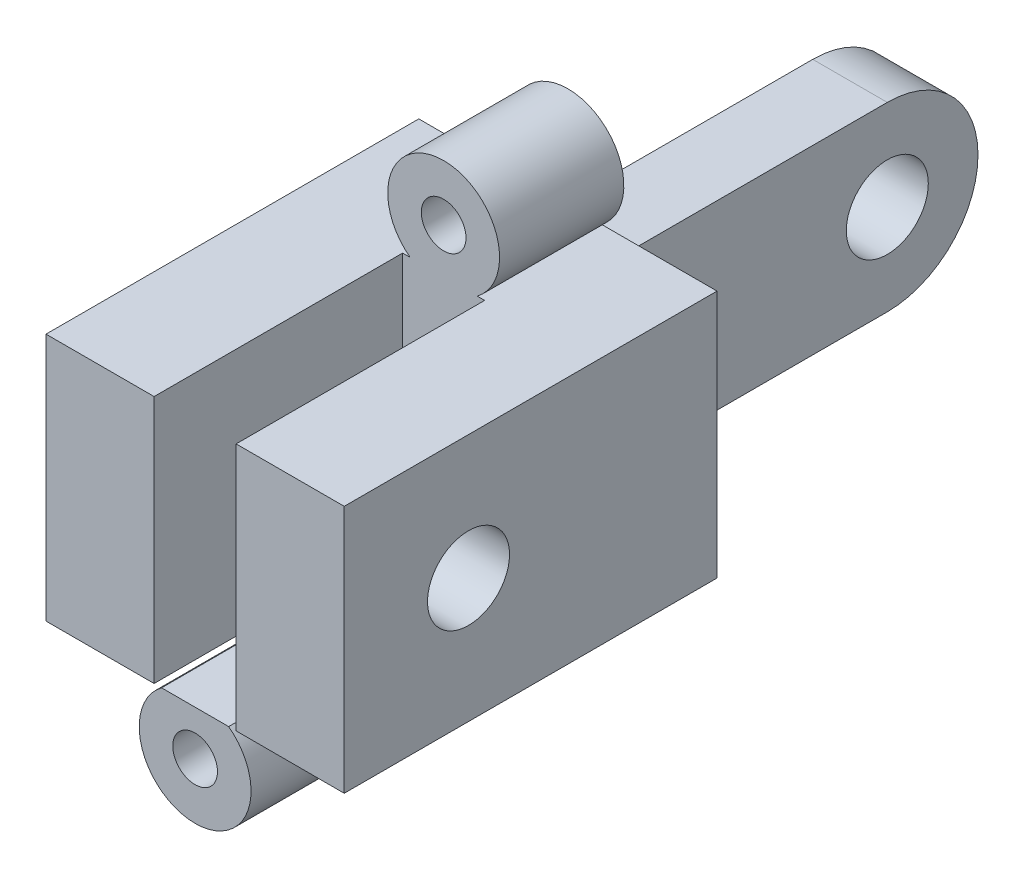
SolidWorks part; units mm, degrees
ref_plane "Front Plane" through (0, 0, 0) normal (0, 0, 1) x (1, 0, 0)
ref_plane "Top Plane" through (0, 0, 0) normal (0, 1, 0) x (1, 0, 0)
ref_plane "Right Plane" through (0, 0, 0) normal (1, 0, 0) x (0, 0, -1)
sketch "Sketch1" plane through (0, 0, 0) normal (0, 1, 0) x (1, 0, 0)
  line L0 (7.65, 0) -> (12, 0)
  line L1 (0, 0) -> (4.35, 0)
  line L2 (0, 0) -> (0, 20)
  line L3 (4.5, 30) -> (7.5, 30)
  line L4 (12, 0) -> (12, 20)
  line L6 (4.35, 0) -> (4.35, 10)
  line L7 (4.35, 10) -> (7.65, 10)
  line L8 (7.65, 0) -> (7.65, 10)
  line L11 (0, 20) -> (4.5, 20)
  line L12 (4.5, 30) -> (4.5, 20)
  line L15 (12, 20) -> (7.5, 20)
  line L16 (7.5, 30) -> (7.5, 20)
  dimension "D1" = 12
  dimension "D3" = 3
  dimension "D4" = 4.5
  dimension "D5" = 10
  dimension "D6" = 10
  dimension "D7" = 3.3
  dimension "D8" = 4.35
  dimension "D9" = 10
extrude "Boss-Extrude1" add sketch "Sketch1" along normal blind 10
sketch "Sketch2" plane through (7.5, 0, 0) normal (1, 0, 0) x (0, 0, -1)
  line L0 (30, 10) -> (30, 0) construction
  line L1 (20, 10) -> (30, 10) construction
  circle A0 centre (26.35, 5) radius 1.65
  dimension "D1" = 3.3
  dimension "D2" = 3.65
  dimension "D3" = 5
extrude "Cut-Extrude1" cut sketch "Sketch2" against normal blind 10
sketch "Sketch3" plane through (7.5, 0, 0) normal (1, 0, 0) x (0, 0, -1)
  line L0 (30, 10) -> (30, 0) construction
  line L1 (20, 10) -> (30, 10)
  line L2 (20, 10) -> (20, 8.65)
  line L3 (20, 8.65) -> (30, 8.65)
  line L4 (30, 10) -> (30, 8.65)
  line L6 (20, 0) -> (30, 0)
  line L7 (20, 0) -> (20, 1.35)
  line L8 (20, 1.35) -> (30, 1.35)
  line L9 (30, 0) -> (30, 1.35)
  circle A0 centre (26.35, 5) radius 1.65 construction
  dimension "D1" = 3.65
  dimension "D2" = 3.65
extrude "Cut-Extrude2" cut sketch "Sketch3" against normal blind 10
fillet "Fillet2" radius 3.65 2 edges at (6, 1.35, -30) (6, 8.65, -30)
sketch "Sketch4" plane through (12, 0, 0) normal (1, 0, 0) x (0, 0, -1)
  line L0 (0, 0) -> (20, 0) construction
  line L1 (0, 10) -> (0, 0) construction
  circle A0 centre (5, 5) radius 1.65
  dimension "D3" = 3.3
  dimension "D1" = 5
  dimension "D2" = 5
extrude "Cut-Extrude3" cut sketch "Sketch4" against normal through all
sketch "Sketch5" plane through (0, 10, 0) normal (0, 1, 0) x (1, 0, 0)
  line L0 (12, 0) -> (12, 20) construction
  line L1 (7.5, 20) -> (12, 20)
  line L2 (7.5, 20) -> (7.5, 15)
  line L3 (7.5, 15) -> (12, 15)
  line L4 (12, 20) -> (12, 15)
  line L5 (0, 20) -> (0, 0) construction
  line L6 (4.5, 20) -> (0, 20)
  line L7 (4.5, 20) -> (4.5, 15)
  line L8 (4.5, 15) -> (0, 15)
  line L9 (0, 20) -> (0, 15)
  dimension "D1" = 5
  dimension "D2" = 5
extrude "Cut-Extrude4" cut sketch "Sketch5" against normal blind 10
sketch "Sketch6" plane through (0, 10, 0) normal (0, 1, 0) x (1, 0, 0)
  line L1 (4.5, 20) -> (7.5, 20)
  line L2 (4.5, 20) -> (4.5, 15)
  line L3 (4.5, 15) -> (7.5, 15)
  line L4 (7.5, 20) -> (7.5, 15)
extrude "Cut-Extrude5" cut sketch "Sketch6" against normal blind 1.35
sketch "Sketch7" plane through (0, 0, 0) normal (0, -1, 0) x (1, 0, 0)
  line L1 (4.5, -15) -> (7.5, -15)
  line L2 (4.5, -15) -> (4.5, -20)
  line L3 (4.5, -20) -> (7.5, -20)
  line L4 (7.5, -15) -> (7.5, -20)
extrude "Cut-Extrude6" cut sketch "Sketch7" against normal blind 1.35
sketch "Sketch8" plane through (0, 0, -10) normal (0, 0, 1) x (1, 0, 0)
  line L1 (7.65, 0) -> (4.35, 0)
  line L2 (7.65, 0) -> (7.65, 0.5)
  line L3 (7.65, 0.5) -> (4.35, 0.5)
  line L4 (4.35, 0) -> (4.35, 0.5)
  dimension "D1" = 3.3
  dimension "D2" = 0.5
sketch "Sketch9" plane through (0, 0, -15) normal (0, 0, -1) x (-1, 0, 0)
  line L0 (0, 0) -> (0, 10) construction
  line L1 (0, 10) -> (-12, 10) construction
  line L2 (-7.35, 10) -> (-4.65, 10)
  arc A0 (-4.65, 10) -> (-7.35, 10) centre (-6, 11.8) ccw
  dimension "D1" = 4.5
  dimension "D2" = 6
  dimension "D3" = 1.8
extrude "Boss-Extrude2" add sketch "Sketch9" against normal blind 5
sketch "Sketch10" plane through (0, 0, -15) normal (0, 0, -1) x (-1, 0, 0)
  line L0 (-7.65, 0) -> (-4.35, 0) construction
  line L1 (0, 0) -> (0, 10) construction
  line L2 (-7.35, 0) -> (-4.65, 0)
  line L3 (0, 0) -> (-12, 0) construction
  arc A0 (-7.35, 0) -> (-4.65, 0) centre (-6, -1.8) ccw
  point P4 (-6, 0)
  dimension "D1" = 4.5
  dimension "D2" = 1.8
  dimension "D3" = 6
extrude "Boss-Extrude3" add sketch "Sketch10" against normal blind 15
sketch "Sketch11" plane through (0, 0, -15) normal (0, 0, -1) x (-1, 0, 0)
  circle A0 centre (-6, 11.8) radius 0.9
  circle A1 centre (-6, -1.8) radius 0.9
  arc A2 (-7.35, 0) -> (-4.65, 0) centre (-6, -1.8) ccw construction
  arc A3 (-4.65, 10) -> (-7.35, 10) centre (-6, 11.8) ccw construction
  dimension "D3" = 1.8
  dimension "D4" = 1.8
  dimension "D1" = 0
  dimension "D2" = 0
extrude "Cut-Extrude7" cut sketch "Sketch11" against normal blind 15
